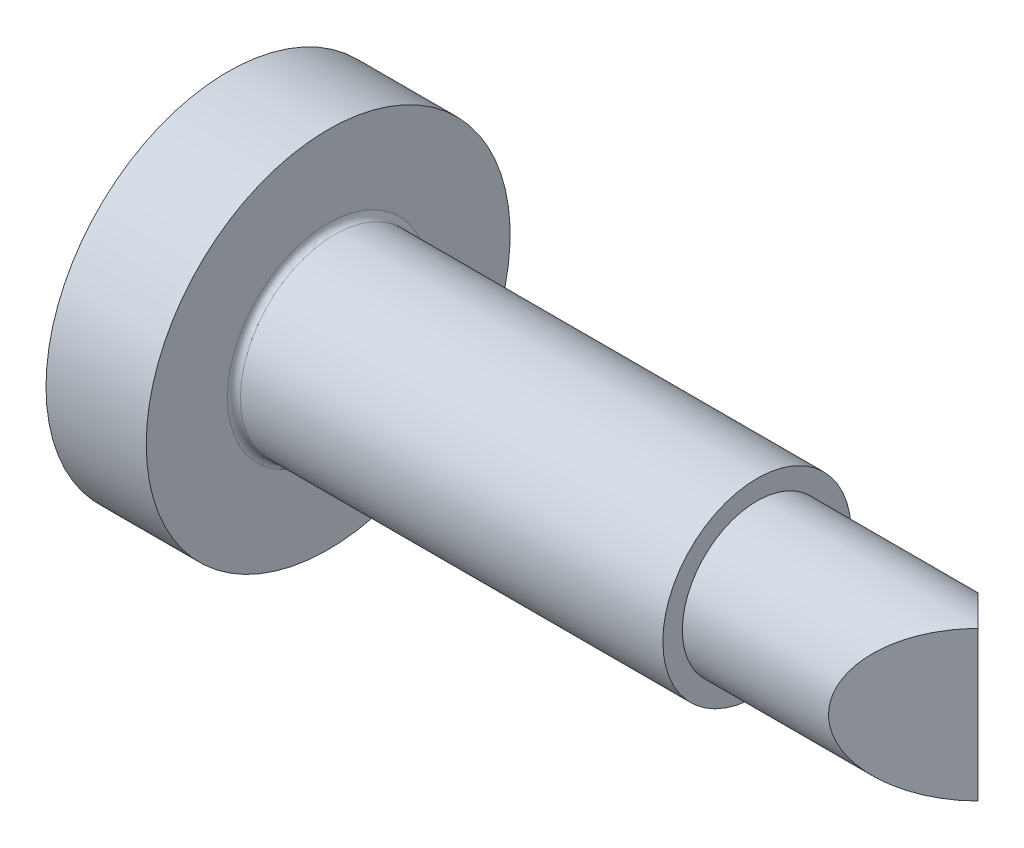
SolidWorks part; units mm, degrees
ref_plane "Front" through (0, 0, 0) normal (0, 0, 1) x (1, 0, 0)
ref_plane "Top" through (0, 0, 0) normal (0, 1, 0) x (1, 0, 0)
ref_plane "Right" through (0, 0, 0) normal (1, 0, 0) x (0, 0, -1)
sketch "Sketch1" plane through (0, 0, 0) normal (0, 0, 1) x (1, 0, 0)
  line L0 (-43.1593, 0) -> (76.0967, 0) construction
  line L1 (2.4, 1.45) -> (9, 1.45)
  line L2 (9, 1.45) -> (9, 1.15)
  line L3 (9, 1.15) -> (12.4, 1.15)
  line L4 (12.4, 1.15) -> (12.4, 0)
  line L5 (2.4, 1.45) -> (2.4, 2.8)
  line L6 (2.4, 2.8) -> (0.8575, 2.8)
  line L7 (12.4, 0) -> (0, 0)
  line L8 (3.5, 4.9815) -> (3.5, -1.8643) construction
  arc A0 (0.8575, 2.8) -> (0, 0) centre (5, 0) ccw
  dimension "r1" = 5
  dimension "d" = 2.9
  dimension "dp" = 2.3
  dimension "dk" = 5.6
  dimension "lg" = 6.6
  dimension "l" = 10
  dimension "k" = 2.4
  dimension "a" = 1.1
revolve "Base" add sketch "Sketch1" angle 360 about L0
fillet "Fillet1" radius 0.1 1 edges at (2.4, 0, 1.45)
sketch "Sketch2" plane through (0, 0, 0) normal (0, 1, 0) x (1, 0, 0)
  line L0 (7.7693, 0) -> (13.786, 0) construction
  line L2 (12.4, 0) -> (11.25, 1.15)
  line L4 (11.25, 1.15) -> (11.25, 1.8746)
  line L5 (11.25, 1.8746) -> (12.7585, 1.8746)
  line L6 (12.7585, 1.8746) -> (12.7585, -1.8746)
  line L8 (11.25, -1.8746) -> (12.7585, -1.8746)
  line L9 (11.25, -1.15) -> (11.25, -1.8746)
  line L10 (12.4, 0) -> (11.25, -1.15)
  line L11 (12.4, -1.15) -> (12.4, 1.15) construction
  line L12 (12.4, 1.15) -> (9, 1.15) construction
  point P14 (12.7585, 0)
  dimension "D1" = 45
  dimension "D2" = 0.7246
  dimension "D3" = 0.3585
extrude "Cut-Extrude1" cut sketch "Sketch2" against normal through all and the other way through all
sketch "Sketch3" plane through (0, 0, 0) normal (1, 0, 0) x (0, 0, -1)
  line L0 (-3.4533, 0) -> (3.7479, 0) construction
  line L1 (0, 3.3142) -> (0, -3.2487) construction
  line L2 (-0.3, 0.3) -> (-1.5, 0.3)
  line L3 (0.3, -1.5) -> (-0.3, -1.5)
  line L4 (0.3, -1.5) -> (0.3, -0.3)
  line L5 (0.3, 1.5) -> (-0.3, 1.5)
  line L6 (-0.3, -1.5) -> (-0.3, -0.3)
  line L7 (1.5, 0.3) -> (0.3, 0.3)
  line L8 (1.5, 0.3) -> (1.5, -0.3)
  line L9 (1.5, -0.3) -> (0.3, -0.3)
  line L10 (-1.5, 0.3) -> (-1.5, -0.3)
  line L11 (0.3, 0.3) -> (0.3, 1.5)
  line L12 (-0.3, 0.3) -> (-0.3, 1.5)
  line L13 (-0.3, -0.3) -> (-1.5, -0.3)
  dimension "D1" = 3
  dimension "m" = 3
  dimension "D3" = 0.6
  dimension "D4" = 0.6
extrude "CrossRecess" cut sketch "Sketch3" along normal blind 0.8
fillet "Fillet2" radius 0.3 4 edges at (0.409, 0.3, 0.3) (0.409, 0.3, -0.3) (0.409, -0.3, 0.3) (0.409, -0.3, -0.3)
draft "Draft1" type of draft neutral plane draft angle 25 neutral plane "Right" faces to draft 4 parameters "D1"=25
sketch "Sketch4" plane through (0, 0, 0) normal (1, 0, 0) x (0, 0, -1)
  line L0 (-13.501, 0) -> (14.0755, 0) construction
  line L1 (0, -11.8062) -> (0, 13.0127) construction
  line L2 (0, 0) -> (-7.5165, 7.5165) construction
  line L3 (0, 0) -> (7.3653, 7.3653) construction
  line L4 (0, 0.4483) -> (1.0607, 1.0607)
  line L5 (0, 0.4483) -> (-1.0607, 1.0607)
  line L6 (1.0607, 1.0607) -> (0.4483, 0)
  line L7 (-1.0607, 1.0607) -> (-0.4483, 0)
  line L8 (-1.0607, -1.0607) -> (-0.4483, 0)
  line L9 (1.0607, -1.0607) -> (0.4483, 0)
  line L10 (0, -0.4483) -> (-1.0607, -1.0607)
  line L11 (0, -0.4483) -> (1.0607, -1.0607)
  dimension "D1" = 45
  dimension "D2" = 15
  dimension "D3" = 3
extrude "Cut-Extrude3" cut sketch "Sketch4" along normal blind 0.8
sketch "Sketch5" plane through (0, 0, 0) normal (0, 0, 1) x (1, 0, 0)
  line L0 (3.3268, 1.7964) -> (3.6732, 1.7964)
  line L1 (3.6732, 1.7964) -> (3.6732, 1.45)
  line L2 (3.6732, 1.45) -> (3.5, 1.15)
  line L3 (3.5, 1.15) -> (3.3268, 1.45)
  line L4 (3.3268, 1.7964) -> (3.3268, 1.45)
  line L5 (0, 0) -> (5.8873, 0) construction
  line L6 (2.4, -2.8) -> (2.4, 2.8) construction
  dimension "D1" = 2.9
  dimension "D2" = 2.3
  dimension "D3" = 1.1
revolve "Cut-Revolve10" [suppressed] cut sketch "Sketch5" angle 360 about L5
pattern_linear "LPattern10" [suppressed] count 13 spacing 0.45 along (1, 0, 0)
equation "\"D4@Sketch3\" = \"D3@Sketch3\""
equation "\"D3@Sketch3\" = \"m@Sketch3\" / 5"
equation "\"D1@Sketch3\" = \"m@Sketch3\""
equation "\"D1@CrossRecess\" = \"k@Sketch1\"  / 3"
equation "\"D1@Cut-Extrude3\" = \"D1@CrossRecess\""
equation "\"D1@Fillet2\" = \"D4@Sketch3\" / 2"
equation "\"D3@Sketch4\" = \"m@Sketch3\""
equation "\"D2@ThreadCosmetic1\" = \"dp@Sketch1\""
equation "\"D1@ThreadCosmetic1\" = \"lg@Sketch1\""
equation "\"D1@Sketch5\" = \"d@Sketch1\""
equation "\"D2@Sketch5\" = \"dp@Sketch1\""
equation "\"D3@Sketch5\" = \"a@Sketch1\""
equation "\"D3@LPattern10\" =  ( \"d@Sketch1\" - \"dp@Sketch1\" ) /2*1.5"
equation "\"D1@LPattern10\" = (  \"lg@Sketch1\" - \"a@Sketch1\" )  / \"D3@LPattern10\"  + 1"
